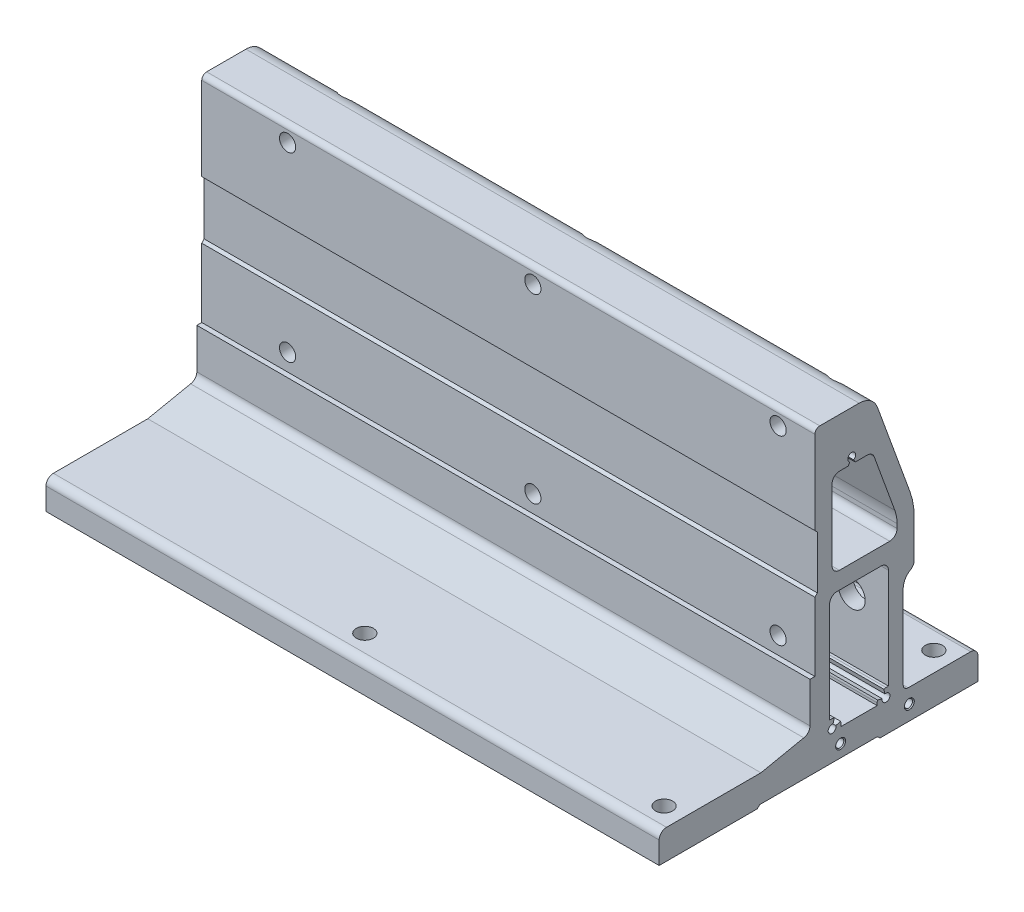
SolidWorks part; units mm, degrees
ref_plane "정면" through (0, 0, 0) normal (0, 0, 1) x (1, 0, 0)
ref_plane "윗면" through (0, 0, 0) normal (0, 1, 0) x (1, 0, 0)
ref_plane "우측면" through (0, 0, 0) normal (1, 0, 0) x (0, 0, -1)
sketch "스케치1" plane through (0, 0, 0) normal (1, 0, 0) x (0, 0, -1)
  line L41 (16.5142, 121.5) -> (0.5, 121.5)
  line L42 (-1.5, 119.5) -> (-1.5, 85.5)
  line L43 (-1.5, 85.5) -> (-0.5, 84.5)
  line L44 (-0.5, 84.5) -> (-0.5, 63)
  line L45 (-0.5, 63) -> (-1.5, 62)
  line L46 (-1.5, 62) -> (-1.5, 34)
  line L47 (-1.5, 34) -> (-3.5, 34)
  line L48 (-3.5, 34) -> (-3.5, 17.5661)
  line L49 (-6.0351, 14.6023) -> (-23.5, 11)
  line L50 (-23.5, 11) -> (-62, 11)
  line L51 (-65, 8) -> (-65, -1)
  line L52 (-65, -1) -> (-25, -1)
  line L53 (-25, -1) -> (-24, 0)
  line L54 (-24, 0) -> (24, 0)
  line L55 (24, 0) -> (25, -1)
  line L56 (25, -1) -> (65, -1)
  line L57 (65, -1) -> (65, 8)
  line L58 (62, 11) -> (36.5, 11)
  line L59 (34.5, 13) -> (34.5, 47)
  line L60 (39, 54.7942) -> (39, 69.8213)
  line L61 (37.1908, 80.0819) -> (24.0317, 116.2362)
  line L62 (25.5, 59.5) -> (7.5, 59.5)
  line L63 (4.5, 56.5) -> (4.5, 15.6)
  line L64 (4.5, 15.6) -> (5.5, 15.6)
  line L65 (6.4317, 15.4773) -> (5.9141, 13.5455)
  line L66 (7.0455, 12.4141) -> (8.9773, 12.9317)
  line L67 (9.1, 12) -> (9.1, 11)
  line L68 (9.1, 11) -> (23.9, 11)
  line L69 (23.9, 11) -> (23.9, 12)
  line L70 (24.0227, 12.9317) -> (25.9545, 12.4141)
  line L71 (27.0859, 13.5455) -> (26.5683, 15.4773)
  line L72 (27.5, 15.6) -> (28.5, 15.6)
  line L73 (28.5, 15.6) -> (28.5, 56.5)
  line L74 (12.7, 102.6144) -> (12.0566, 101.5)
  line L75 (12.0566, 101.5) -> (8.5, 101.5)
  line L76 (5.5, 98.5) -> (5.5, 69.5)
  line L77 (8.5, 66.5) -> (29, 66.5)
  line L78 (32, 69.5) -> (32, 71.2319)
  line L79 (31.0954, 76.3622) -> (22.6644, 99.5261)
  line L80 (19.8454, 101.5) -> (14.9434, 101.5)
  line L81 (14.9434, 101.5) -> (14.3, 102.6144)
  arc A23 (0.5, 121.5) -> (-1.5, 119.5) centre (0.5, 119.5) ccw
  arc A24 (-6.0351, 14.6023) -> (-3.5, 17.5661) centre (-6.5, 17.5661) ccw
  arc A25 (-62, 11) -> (-65, 8) centre (-62, 8) ccw
  arc A26 (65, 8) -> (62, 11) centre (62, 8) ccw
  arc A27 (34.5, 13) -> (36.5, 11) centre (36.5, 13) ccw
  arc A28 (37.5, 52.1962) -> (34.5, 47) centre (40.5, 47) ccw
  arc A29 (37.5, 52.1962) -> (39, 54.7942) centre (36, 54.7942) ccw
  arc A30 (39, 69.8213) -> (37.1908, 80.0819) centre (9, 69.8213) ccw
  arc A31 (24.0317, 116.2362) -> (16.5142, 121.5) centre (16.5142, 113.5) ccw
  arc A32 (7.5, 59.5) -> (4.5, 56.5) centre (7.5, 56.5) ccw
  arc A33 (6.4317, 15.4773) -> (5.5, 15.6) centre (5.5, 12) ccw
  arc A34 (5.9141, 13.5455) -> (7.0455, 12.4141) centre (5.5, 12) ccw
  arc A35 (9.1, 12) -> (8.9773, 12.9317) centre (5.5, 12) ccw
  arc A36 (24.0227, 12.9317) -> (23.9, 12) centre (27.5, 12) ccw
  arc A37 (25.9545, 12.4141) -> (27.0859, 13.5455) centre (27.5, 12) ccw
  arc A38 (27.5, 15.6) -> (26.5683, 15.4773) centre (27.5, 12) ccw
  arc A39 (28.5, 56.5) -> (25.5, 59.5) centre (25.5, 56.5) ccw
  arc A40 (14.3, 102.6144) -> (12.7, 102.6144) centre (13.5, 104) ccw
  arc A41 (8.5, 101.5) -> (5.5, 98.5) centre (8.5, 98.5) ccw
  arc A42 (5.5, 69.5) -> (8.5, 66.5) centre (8.5, 69.5) ccw
  arc A43 (29, 66.5) -> (32, 69.5) centre (29, 69.5) ccw
  arc A44 (32, 71.2319) -> (31.0954, 76.3622) centre (17, 71.2319) ccw
  arc A45 (22.6644, 99.5261) -> (19.8454, 101.5) centre (19.8454, 98.5) ccw
extrude "보스-돌출1" add sketch "스케치1" along normal mid plane 250
hole_wizard "M6 소켓 머리 캡 나사용 카운터보어1" positions "스케치2" profile "스케치3" counterbore size "M6" standard "KS"
sketch "스케치2" plane through (0, 0, -39) normal (0, 0, -1) x (-1, 0, 0)
  line L1 (-125, 80.0819) -> (-125, 116.2362) construction
  line L2 (-125, -1) -> (125, -1) construction
  point P0 (-110, 115)
  point P6 (-110, 41)
  dimension "D1" = 74
  dimension "D2" = 42
  dimension "D3" = 15
sketch "스케치3" plane through (110, 115, -39) normal (1, 0, 0) x (0, 1, 0)
  line L0 (0, 0) -> (0, 104)
  line L1 (0, 104) -> (3.3, 104)
  line L3 (3.3, 104) -> (3.3, 34.5)
  line L4 (3.3, 34.5) -> (5.5, 34.5)
  line L5 (5.5, 34.5) -> (5.5, 0)
  line L7 (5.5, 0) -> (0, 0)
  line L11 (0, -6.35) -> (0, 107.95) construction
  dimension "관통 구멍 지름" = 6.6
  dimension "관통 구멍 깊이" = 104
  dimension "카운터보어 지름" = 11
  dimension "카운터보어 깊이" = 34.5
pattern_linear "선형 패턴1" count 3 spacing 100 along (-1, 0, 0) of "M6 소켓 머리 캡 나사용 카운터보어1"
hole_wizard "M4 나사 구멍1" positions "스케치4" profile "스케치5" tap size "M4" standard "ISO"
sketch "스케치4" plane through (125, 0, 0) normal (1, 0, 0) x (0, 0, -1)
  line L0 (65, -1) -> (65, 8) construction
  line L1 (25, -1) -> (65, -1) construction
  point P0 (37, 5)
  point P2 (9, 5)
  dimension "D1" = 28
  dimension "D2" = 28
  dimension "D3" = 6
sketch "스케치5" plane through (125, 5, -37) normal (0, 1, 0) x (0, 0, -1)
  line L0 (0, 0) -> (0, 10.9914)
  line L1 (0, 10.9914) -> (1.65, 10)
  line L2 (1.65, 10) -> (1.65, 0.375)
  line L3 (1.65, 0.375) -> (2.025, 0)
  line L5 (2.025, 0) -> (0, 0)
  line L6 (-1.65, 0.375) -> (-2.025, 0) construction
  line L10 (0, 10.9914) -> (-1.65, 10) construction
  line L11 (0, -6.35) -> (0, 107.95) construction
  dimension "탭 드릴 지름" = 3.3
  dimension "탭 드릴 깊이" = 10
  dimension "표면 카운터싱크 지름" = 4.05
  dimension "표면 카운터싱크 각도" = 90
  dimension "드릴 각도" = 118
hole_wizard "Ø5.0mm 맞춤핀 구멍1" positions "스케치6" profile "스케치7" hole size "Ø5.0" standard "ISO"
sketch "스케치6" plane through (0, 0, 0) normal (0, -1, 0) x (-1, 0, 0)
  line L0 (0, 0) -> (-138.2051, 0) construction
  line L1 (-125, -24) -> (-125, 24) construction
  point P5 (-117, 0)
  point P7 (5, 0)
  dimension "D1" = 122
  dimension "D2" = 8
sketch "스케치7" plane through (-5, 0, 0) normal (1, 0, 0) x (0, 0, -1)
  line L0 (0, 0) -> (0, 11.5022)
  line L1 (0, 11.5022) -> (2.5, 10)
  line L2 (2.5, 10) -> (2.5, 0)
  line L5 (2.5, 0) -> (0, 0)
  line L10 (0, 11.5022) -> (-2.5, 10) construction
  line L11 (0, -6.35) -> (0, 107.95) construction
  dimension "구멍 지름" = 5
  dimension "구멍 깊이" = 10
  dimension "드릴 각도" = 118
hole_wizard "Ø7.0 (7) 지름 구멍1" positions "스케치8" profile "스케치9" hole size "Ø7.0" standard "ISO"
sketch "스케치8" plane through (0, -1, 0) normal (0, -1, 0) x (-1, 0, 0)
  line L0 (-125, -65) -> (125, -65) construction
  line L2 (-125, -65) -> (-125, -25) construction
  point P0 (-117, -55)
  point P2 (5, -55)
  point P4 (5, 55)
  point P6 (-117, 55)
  dimension "D1" = 110
  dimension "D2" = 10
  dimension "D3" = 8
  dimension "D4" = 122
sketch "스케치9" plane through (117, -1, 55) normal (1, 0, 0) x (0, 0, -1)
  line L0 (0, 0) -> (0, 122.5)
  line L1 (0, 122.5) -> (3.5, 122.5)
  line L2 (3.5, 122.5) -> (3.5, 0)
  line L5 (3.5, 0) -> (0, 0)
  line L11 (0, -6.35) -> (0, 107.95) construction
  dimension "관통 구멍 지름" = 7
  dimension "관통 구멍 깊이" = 122.5
